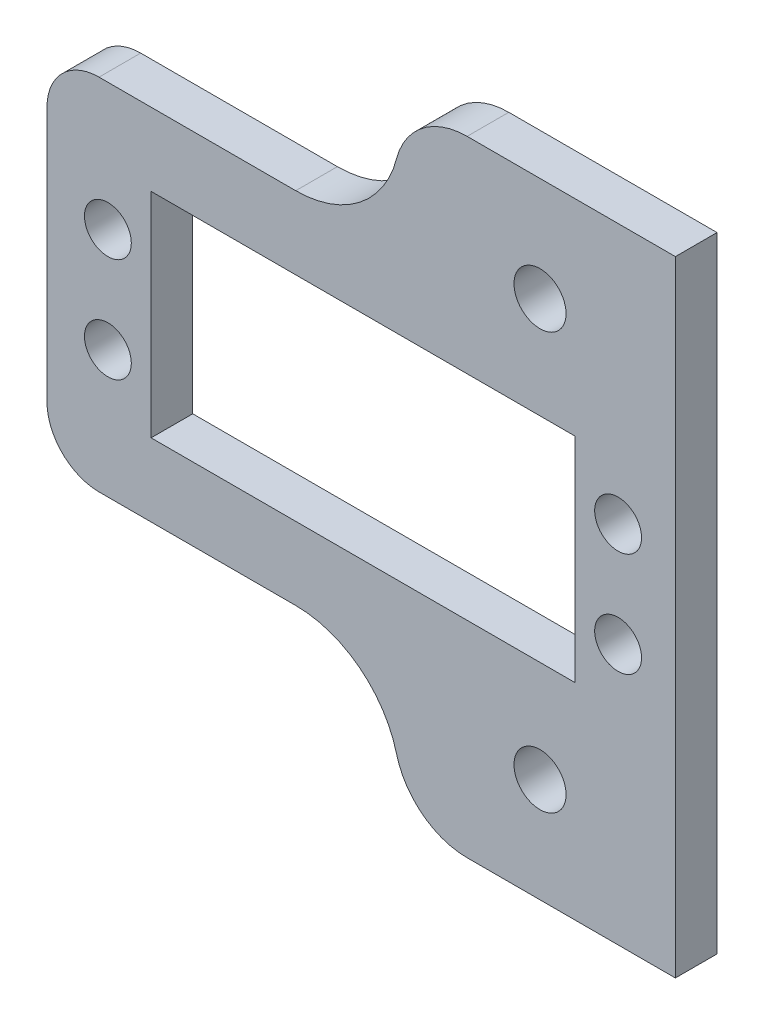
SolidWorks part; units mm, degrees
ref_plane "Front Plane" through (0, 0, 0) normal (0, 0, 1) x (1, 0, 0)
ref_plane "Top Plane" through (0, 0, 0) normal (0, 1, 0) x (1, 0, 0)
ref_plane "Right Plane" through (0, 0, 0) normal (1, 0, 0) x (0, 0, -1)
sketch "Sketch1" plane through (0, 0, 0) normal (0, 0, 1) x (1, 0, 0)
  line L0 (30, -30) -> (30, 30)
  line L1 (-30.35, -12.25) -> (-30.35, 12.25)
  line L2 (-30.35, 0) -> (30, 0) construction
  line L3 (10, -30) -> (30, -30)
  line L4 (17, 20) -> (17, 30) construction
  line L5 (17, -20) -> (17, -30) construction
  line L6 (-25.35, -17.25) -> (-6.4602, -17.25)
  line L7 (-25.35, 17.25) -> (-6.4602, 17.25)
  line L8 (10, 30) -> (30, 30)
  line L28 (-24.5, -5) -> (24.5, 5) construction
  line L29 (20.35, 10.25) -> (-20.35, 10.25)
  line L30 (20.35, 10.25) -> (20.35, -10.25)
  line L31 (20.35, -10.25) -> (-20.35, -10.25)
  line L32 (-20.35, 10.25) -> (-20.35, -10.25)
  line L33 (20.35, 10.25) -> (-20.35, -10.25) construction
  line L34 (20.35, -10.25) -> (-20.35, 10.25) construction
  arc A0 (-30.35, 12.25) -> (-25.35, 17.25) centre (-25.35, 12.25) cw
  arc A1 (-30.35, -12.25) -> (-25.35, -17.25) centre (-25.35, -12.25) ccw
  circle A2 centre (17, 20) radius 2.5
  circle A3 centre (17, -20) radius 2.5
  arc A4 (-6.4602, -17.25) -> (3.2223, -24.75) centre (-6.4602, -27.25) cw
  arc A5 (3.2223, -24.75) -> (10, -30) centre (10, -23) ccw
  arc A6 (-6.4602, 17.25) -> (3.2223, 24.75) centre (-6.4602, 27.25) ccw
  circle A7 centre (-24.5, -5) radius 2.25
  circle A8 centre (24.5, -5) radius 2.25
  circle A9 centre (24.5, 5) radius 2.25
  circle A10 centre (-24.5, 5) radius 2.25
  arc A11 (3.2223, 24.75) -> (10, 30) centre (10, 23) cw
  point P0 (0, 0)
  point P11 (30, 0)
  point P60 (0, 0)
  point P61 (0, 0)
  dimension "D5" = 4.5
  dimension "D6" = 7
  dimension "D8" = 5
  dimension "D9" = 10
  dimension "D13" = 7
  dimension "D15" = 5
  dimension "D1" = 40.7
  dimension "D2" = 20.5
  dimension "D3" = 49
  dimension "D4" = 10
  dimension "D7" = 60
  dimension "D10" = 30
  dimension "D11" = 10
  dimension "D12" = 13
  dimension "D14" = 20
  dimension "D16" = 10
extrude "Boss-Extrude1" add sketch "Sketch1" along normal mid plane 4
